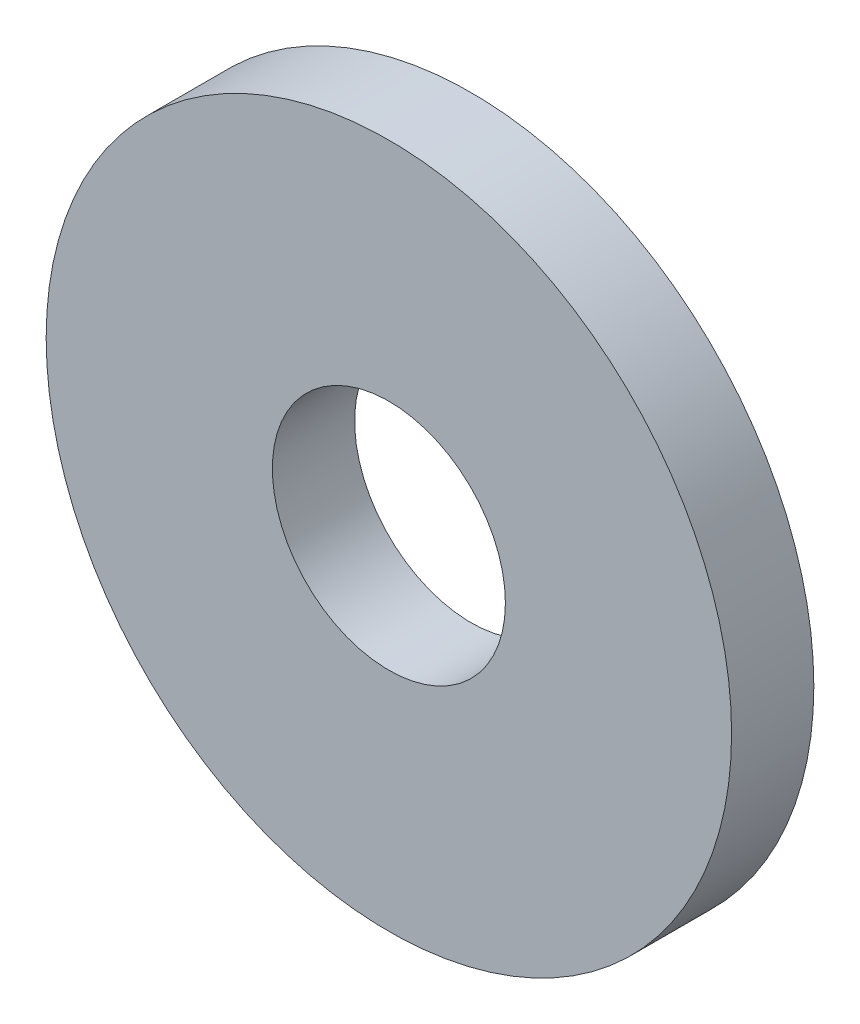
SolidWorks part; units mm, degrees
ref_plane "Plan1" through (0, 0, 0) normal (0, 0, 1) x (1, 0, 0)
ref_plane "Plan2" through (0, 0, 0) normal (0, 1, 0) x (1, 0, 0)
ref_plane "Plan3" through (0, 0, 0) normal (1, 0, 0) x (0, 0, -1)
sketch "Esquisse1" plane through (0, 0, 0) normal (0, 0, 1) x (1, 0, 0)
  circle A0 centre (0, 0) radius 2.5
  circle A1 centre (0, 0) radius 0.85
  dimension "D1" = 5
  dimension "D2" = 1.7
extrude "Extrusion1" add sketch "Esquisse1" along normal blind 0.6
